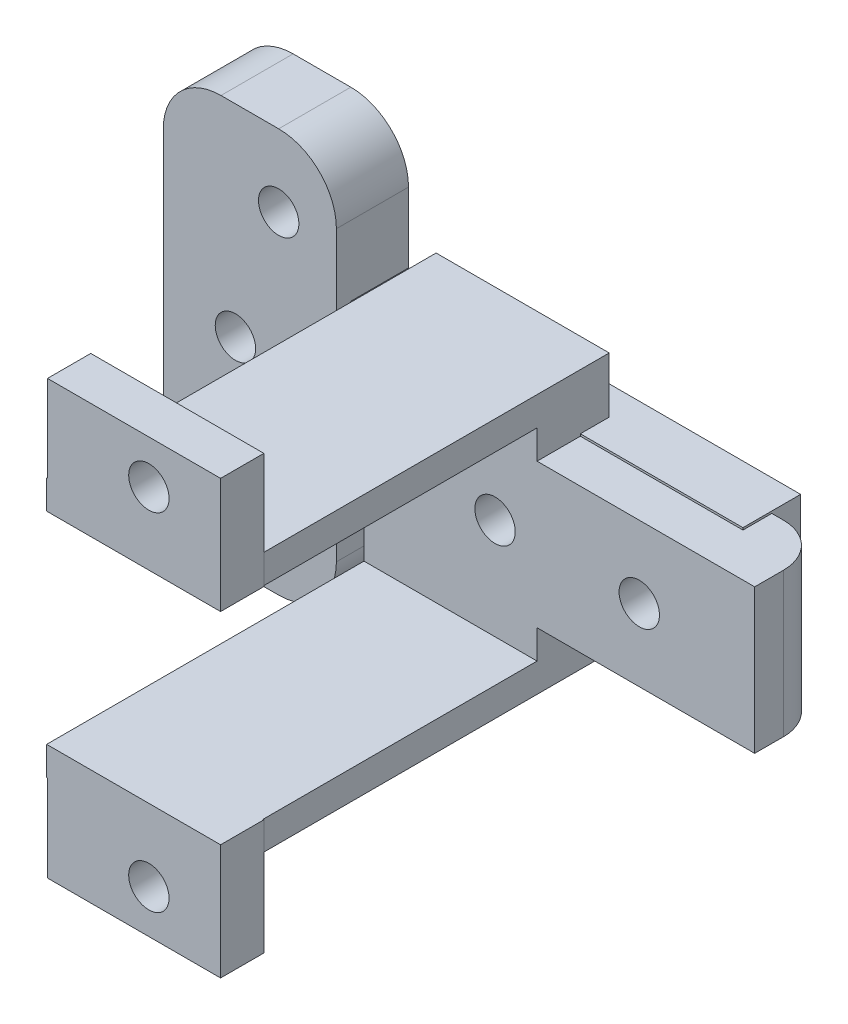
SolidWorks part; units mm, degrees
ref_plane "Front Plane" through (0, 0, 0) normal (0, 0, 1) x (1, 0, 0)
ref_plane "Top Plane" through (0, 0, 0) normal (0, 1, 0) x (1, 0, 0)
ref_plane "Right Plane" through (0, 0, 0) normal (1, 0, 0) x (0, 0, -1)
sketch "Sketch1" plane through (0, 0, 0) normal (0, 1, 0) x (1, 0, 0)
  line L0 (18, 1.75) -> (0, 1.75)
  line L1 (0, 1.75) -> (0, 3.75)
  line L3 (18, 1.75) -> (18, -1.25)
  line L4 (18, -1.25) -> (43, -1.25)
  line L5 (43, -1.25) -> (43, 3.75)
  line L6 (43, 3.75) -> (0, 3.75)
  point P0 (0, 0)
  dimension "D4" = 25
  dimension "D5" = 5
extrude "Boss-Extrude1" add sketch "Sketch1" along normal blind 10
sketch "Sketch5" plane through (0, 0, -3.75) normal (0, 0, -1) x (-1, 0, 0)
  line L0 (-43, 0) -> (0, 0) construction
  line L1 (-27.914, -4) -> (-15.914, -4)
  line L2 (-27.914, -4) -> (-27.914, 14)
  line L3 (-27.914, 14) -> (-15.914, 14)
  line L4 (-15.914, -4) -> (-15.914, 14)
  line L5 (-43, 10) -> (0, 10) construction
  dimension "D1" = 4
  dimension "D2" = 4
  dimension "D3" = 12
extrude "Boss-Extrude3" add sketch "Sketch5" against normal blind 27
sketch "Sketch7" plane through (0, 0, 1.25) normal (0, 0, 1) x (1, 0, 0)
  line L1 (12, -2) -> (28, -2)
  line L2 (12, -2) -> (12, 12)
  line L3 (12, 12) -> (28, 12)
  line L4 (28, -2) -> (28, 12)
  point P4 (0, 0)
  point P5 (0, 0)
  point P6 (0, 0)
  point P7 (0, 0)
  point P8 (0, 0)
  point P9 (0, 0)
  point P10 (0, 0)
  point P11 (0, 0)
  dimension "D1" = 14
extrude "Cut-Extrude2" cut sketch "Sketch7" along normal blind 28
sketch "Sketch8" plane through (0, 0, 23.25) normal (0, 0, 1) x (1, 0, 0)
  line L1 (27.972, 12) -> (15.972, 12)
  line L2 (27.972, 12) -> (27.972, 20)
  line L3 (27.972, 20) -> (15.972, 20)
  line L4 (15.972, 12) -> (15.972, 20)
  point P4 (0, 0)
  dimension "D1" = 12
  dimension "D2" = 8
extrude "Boss-Extrude4" add sketch "Sketch8" against normal blind 3
ref_plane "Plane1" through (0, 5, 0) normal (0, 1, 0) x (1, 0, 0)
mirror "Mirror1" about plane through (0, 5, 0) normal (0, 1, 0) of "Boss-Extrude4"
sketch "Sketch9" plane through (0, 0, 20.25) normal (0, 0, -1) x (-1, 0, 0)
  circle A0 centre (-23, 17) radius 1.4
extrude "Cut-Extrude3" cut sketch "Sketch9" against normal blind 3
mirror "Mirror2" about plane through (0, 5, 0) normal (0, 1, 0) of "Cut-Extrude3"
sketch "Sketch10" plane through (0, 0, -3.75) normal (0, 0, -1) x (-1, 0, 0)
  circle A0 centre (-35, 5) radius 1.4
  circle A1 centre (-25, 5) radius 1.4
  circle A2 centre (-15, 5) radius 1.4
  circle A3 centre (-5, 5) radius 1.4
  dimension "D1" = 4
sketch "Sketch12" plane through (0, 0, -1.75) normal (0, 0, 1) x (1, 0, 0)
  line L0 (0, 0) -> (15.914, 0) construction
  line L1 (0, -9) -> (12, -9)
  line L2 (0, -9) -> (0, 19)
  line L3 (0, 19) -> (12, 19)
  line L4 (12, -9) -> (12, 19)
  dimension "D1" = 28
  dimension "D2" = 12
  dimension "D3" = 9
extrude "Boss-Extrude6" add sketch "Sketch12" along normal blind 1 and the other way blind 4
sketch "Sketch13" plane through (0, 0, -3.75) normal (0, 0, -1) x (-1, 0, 0)
  line L1 (-39.1866, 10.1458) -> (-12, 10.1458)
  line L2 (-39.1866, 10.1458) -> (-39.1866, 0)
  line L3 (-39.1866, 0) -> (-12, 0)
  line L4 (-12, 10.1458) -> (-12, 0)
extrude "Boss-Extrude7" add sketch "Sketch13" along normal blind 2 and the other way blind 2
fillet "Fillet3" radius 3 1 edges at (43, 5, -3.75)
extrude "Cut-Extrude4" cut sketch "Sketch10" against normal blind 5 and the other way blind 9
sketch "Sketch14" plane through (0, 0, -5.75) normal (0, 0, -1) x (-1, 0, 0)
  line L0 (0, 19) -> (0, -9) construction
  line L1 (-12, 19) -> (0, 19) construction
  circle A0 centre (-8, 14) radius 1.4
  circle A1 centre (-8, -4) radius 1.4
  dimension "D1" = 8
  dimension "D2" = 18
  dimension "D3" = 5
extrude "Cut-Extrude5" cut sketch "Sketch14" against normal blind 6
fillet "Fillet5" radius 4 4 edges at (0, 19, -3.25) (12, 19, -3.25) (12, -9, -3.25) (0, -9, -3.25)
